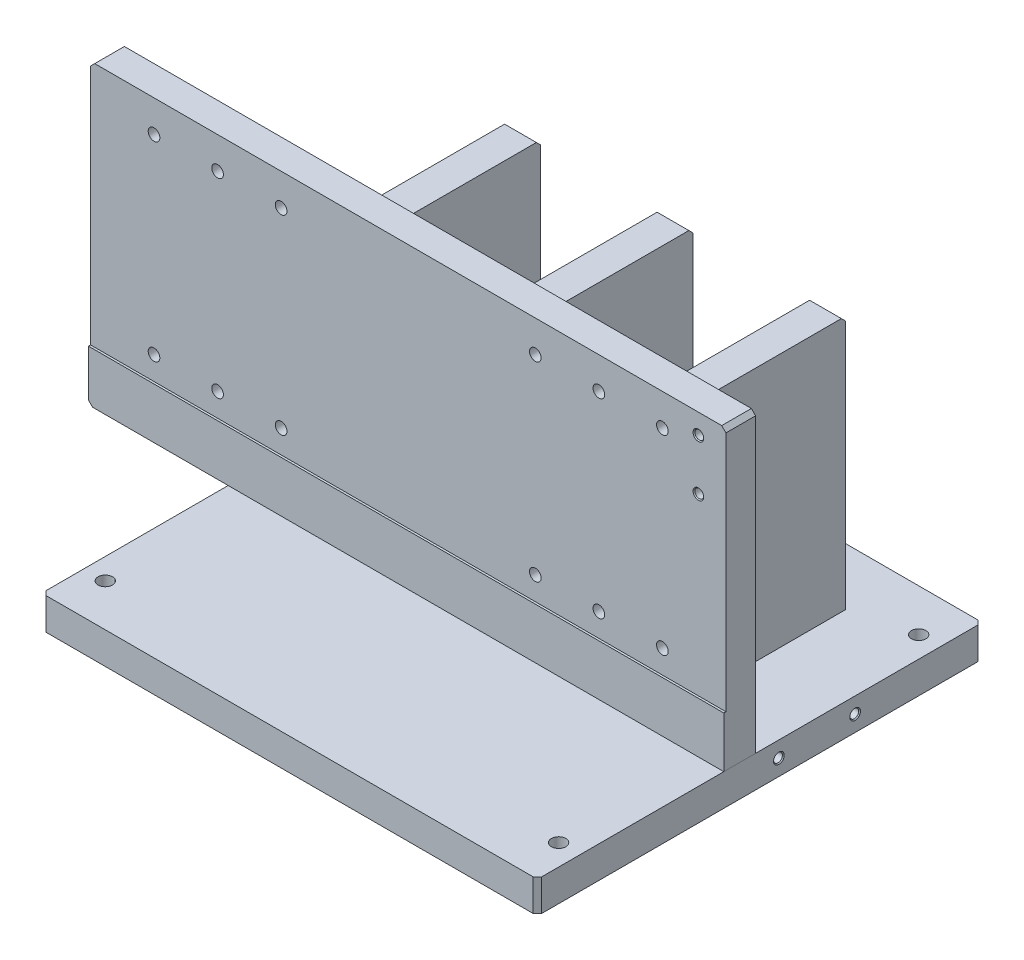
SolidWorks part; units mm, degrees
ref_plane "정면" through (0, 0, 0) normal (0, 0, 1) x (1, 0, 0)
ref_plane "윗면" through (0, 0, 0) normal (0, 1, 0) x (1, 0, 0)
ref_plane "우측면" through (0, 0, 0) normal (1, 0, 0) x (0, 0, -1)
sketch "스케치1" plane through (0, 0, 0) normal (0, 1, 0) x (1, 0, 0)
  line L1 (-117, 105) -> (117, 105)
  line L2 (-117, 105) -> (-117, -105)
  line L3 (-117, -105) -> (117, -105)
  line L4 (117, 105) -> (117, -105)
  line L5 (-117, 105) -> (117, -105) construction
  line L6 (-117, -105) -> (117, 105) construction
  point P0 (0, 0)
  dimension "D1" = 234
  dimension "D2" = 210
extrude "보스-돌출1" add sketch "스케치1" along normal blind 15
sketch "스케치2" plane through (0, 15, 0) normal (0, 1, 0) x (1, 0, 0)
  line L0 (117, -105) -> (117, 105) construction
  line L1 (117, -2) -> (-183, -2)
  line L2 (117, -2) -> (117, -17)
  line L3 (117, -17) -> (-183, -17)
  line L4 (-183, -2) -> (-183, -17)
  line L5 (117, 105) -> (-117, 105) construction
  dimension "D1" = 15
  dimension "D2" = 300
  dimension "D3" = 107
extrude "보스-돌출2" add sketch "스케치2" along normal blind 140 separate body
sketch "스케치3" plane through (0, 0, 17) normal (0, 0, 1) x (1, 0, 0)
  line L0 (117, 155) -> (117, 15) construction
  line L1 (-183, 155) -> (117, 155)
  line L2 (-183, 155) -> (-183, 39)
  line L3 (-183, 39) -> (117, 39)
  line L4 (117, 155) -> (117, 39)
  line L5 (-117, 0) -> (117, 0) construction
  dimension "D1" = 39
extrude "컷-돌출1" cut sketch "스케치3" against normal blind 1
sketch "스케치4" plane through (0, 15, 0) normal (0, 1, 0) x (1, 0, 0)
  line L0 (117, -2) -> (-183, -2) construction
  line L1 (-79.5, -2) -> (-64.5, -2)
  line L2 (-79.5, -2) -> (-79.5, 78)
  line L3 (-79.5, 78) -> (-64.5, 78)
  line L4 (-64.5, -2) -> (-64.5, 78)
  line L5 (-117, 105) -> (-117, -105) construction
  line L6 (-7.5, -2) -> (7.5, -2)
  line L7 (-7.5, -2) -> (-7.5, 78)
  line L8 (-7.5, 78) -> (7.5, 78)
  line L9 (7.5, -2) -> (7.5, 78)
  line L10 (64.5, -2) -> (79.5, -2)
  line L11 (64.5, -2) -> (64.5, 78)
  line L12 (64.5, 78) -> (79.5, 78)
  line L13 (79.5, -2) -> (79.5, 78)
  dimension "D1" = 37.5
  dimension "D2" = 15
  dimension "D3" = 57
  dimension "D4" = 57
  dimension "D5" = 80
extrude "보스-돌출3" add sketch "스케치4" along normal blind 120 separate body
sketch "스케치5" plane through (-79.5, 0, 0) normal (-1, 0, 0) x (0, 0, 1)
  line L0 (-78, 135) -> (-78, 133)
  line L1 (-78, 135) -> (-78, 15) construction
  line L2 (-78, 133) -> (-76, 135)
  line L3 (-78, 135) -> (2, 135) construction
  line L4 (-76, 135) -> (-78, 135)
  dimension "D1" = 2
  dimension "D2" = 2
extrude "컷-돌출2" cut sketch "스케치5" against normal through all
hole_wizard "M8 나사 구멍1" positions "스케치8" profile "스케치9" tap size "M8" standard "ISO"
sketch "스케치8" plane through (0, 15, 0) normal (0, 1, 0) x (1, 0, 0)
  line L0 (117, 105) -> (-117, 105) construction
  line L2 (-117, 105) -> (-117, -105) construction
  point P0 (-107, 85)
  point P2 (107, 85)
  point P4 (-107, -85)
  point P6 (107, -85)
  dimension "D1" = 20
  dimension "D2" = 170
  dimension "D3" = 10
  dimension "D4" = 214
sketch "스케치9" plane through (-107, 15, -85) normal (1, 0, 0) x (0, 0, 1)
  line L0 (0, 0) -> (0, 15)
  line L1 (0, 15) -> (3.4, 15)
  line L2 (3.4, 15) -> (3.4, 0)
  line L5 (3.4, 0) -> (0, 0)
  line L11 (0, -6.35) -> (0, 107.95) construction
  dimension "관통 탭 드릴 지름" = 6.8
  dimension "관통 탭 드릴 깊이" = 15
hole_wizard "Ø6.0mm 맞춤핀 구멍1" positions "스케치10" profile "스케치11" hole size "Ø6.0" standard "ISO"
sketch "스케치10" plane through (0, 0, 0) normal (0, -1, 0) x (-1, 0, 0)
  line L0 (0, 0) -> (-161.396, 0) construction
  line L1 (117, 105) -> (117, -105) construction
  point P6 (-107, 0)
  point P8 (107, 0)
  dimension "D1" = 10
  dimension "D2" = 214
sketch "스케치11" plane through (-107, 0, 0) normal (1, 0, 0) x (0, 0, -1)
  line L0 (0, 0) -> (0, 11.8026)
  line L1 (0, 11.8026) -> (3, 10)
  line L2 (3, 10) -> (3, 0)
  line L5 (3, 0) -> (0, 0)
  line L10 (0, 11.8026) -> (-3, 10) construction
  line L11 (0, -6.35) -> (0, 107.95) construction
  dimension "구멍 지름" = 6
  dimension "구멍 깊이" = 10
  dimension "드릴 각도" = 118
hole_wizard "M5 소켓 머리 캡 나사용 카운터보어1" positions "스케치12" profile "스케치13" counterbore size "M5" standard "KS"
sketch "스케치12" plane through (0, 0, 2) normal (0, 0, -1) x (-1, 0, 0)
  line L0 (-117, 15) -> (183, 15) construction
  line L1 (-117, 155) -> (-117, 15) construction
  point P0 (-87, 140)
  point P2 (-57, 140)
  point P4 (-27, 140)
  point P6 (-87, 50)
  point P8 (-27, 50)
  point P10 (-57, 50)
  dimension "D1" = 35
  dimension "D2" = 90
  dimension "D3" = 30
  dimension "D4" = 30
  dimension "D5" = 30
sketch "스케치13" plane through (87, 140, 2) normal (1, 0, 0) x (0, 1, 0)
  line L0 (0, 0) -> (0, 103)
  line L1 (0, 103) -> (2.75, 103)
  line L3 (2.75, 103) -> (2.75, 7)
  line L4 (2.75, 7) -> (4.75, 7)
  line L5 (4.75, 7) -> (4.75, 0)
  line L7 (4.75, 0) -> (0, 0)
  line L11 (0, -6.35) -> (0, 107.95) construction
  dimension "관통 구멍 지름" = 5.5
  dimension "관통 구멍 깊이" = 103
  dimension "카운터보어 지름" = 9.5
  dimension "카운터보어 깊이" = 7
pattern_linear "선형 패턴1" count 2 spacing 180 along (-1, 0, 0) of "M5 소켓 머리 캡 나사용 카운터보어1"
hole_wizard "M5 나사 구멍1" positions "스케치14" profile "스케치15" tap size "M5" standard "ISO"
sketch "스케치14" plane through (0, 0, 16) normal (0, 0, 1) x (1, 0, 0)
  line L0 (117, 155) -> (-183, 155) construction
  line L1 (117, 39) -> (117, 155) construction
  point P0 (104, 145.5)
  point P2 (104, 121.5)
  dimension "D1" = 24
  dimension "D2" = 9.5
  dimension "D3" = 13
sketch "스케치15" plane through (104, 145.5, 16) normal (1, 0, 0) x (0, -1, 0)
  line L0 (0, 0) -> (0, 121)
  line L1 (0, 121) -> (2.525, 121)
  line L2 (2.1, 120.575) -> (2.1, 0.425)
  line L3 (2.1, 0.425) -> (2.525, 0)
  line L5 (2.525, 0) -> (0, 0)
  line L6 (-2.1, 0.425) -> (-2.525, 0) construction
  line L7 (2.525, 121) -> (2.1, 120.575)
  line L8 (-2.525, 121) -> (-2.1, 120.575) construction
  line L11 (0, -6.35) -> (0, 107.95) construction
  dimension "관통 탭 드릴 지름" = 4.2
  dimension "관통 탭 드릴 깊이" = 121
  dimension "표면 카운터싱크 지름" = 5.05
  dimension "표면 카운터싱크 각도" = 90
  dimension "안쪽면 카운터싱크 지름" = 5.05
  dimension "안쪽면 카운터싱크 각도" = 90
hole_wizard "M5 나사 구멍2" positions "스케치16" profile "스케치17" tap size "M5" standard "ISO"
sketch "스케치16" plane through (117, 0, 0) normal (1, 0, 0) x (0, 0, -1)
  line L0 (105, 15) -> (105, 0) construction
  line L1 (-105, 0) -> (105, 0) construction
  point P0 (9, 7.5)
  point P2 (45, 7.5)
  dimension "D1" = 60
  dimension "D2" = 36
  dimension "D3" = 7.5
sketch "스케치17" plane through (117, 7.5, -9) normal (0, 1, 0) x (0, 0, -1)
  line L0 (0, 0) -> (0, 13.2618)
  line L1 (0, 13.2618) -> (2.1, 12)
  line L2 (2.1, 12) -> (2.1, 0.425)
  line L3 (2.1, 0.425) -> (2.525, 0)
  line L5 (2.525, 0) -> (0, 0)
  line L6 (-2.1, 0.425) -> (-2.525, 0) construction
  line L10 (0, 13.2618) -> (-2.1, 12) construction
  line L11 (0, -6.35) -> (0, 107.95) construction
  dimension "탭 드릴 지름" = 4.2
  dimension "탭 드릴 깊이" = 12
  dimension "표면 카운터싱크 지름" = 5.05
  dimension "표면 카운터싱크 각도" = 90
  dimension "드릴 각도" = 118
chamfer "모따기1" distance 2 angle 45 3 edges at (-183, 15, 9.5) (-183, 155, 9) (117, 155, 9)
chamfer "모따기2" distance 2 angle 45 4 edges at (117, 7.5, -105) (-117, 7.5, -105) (117, 7.5, 105) (-117, 7.5, 105)
